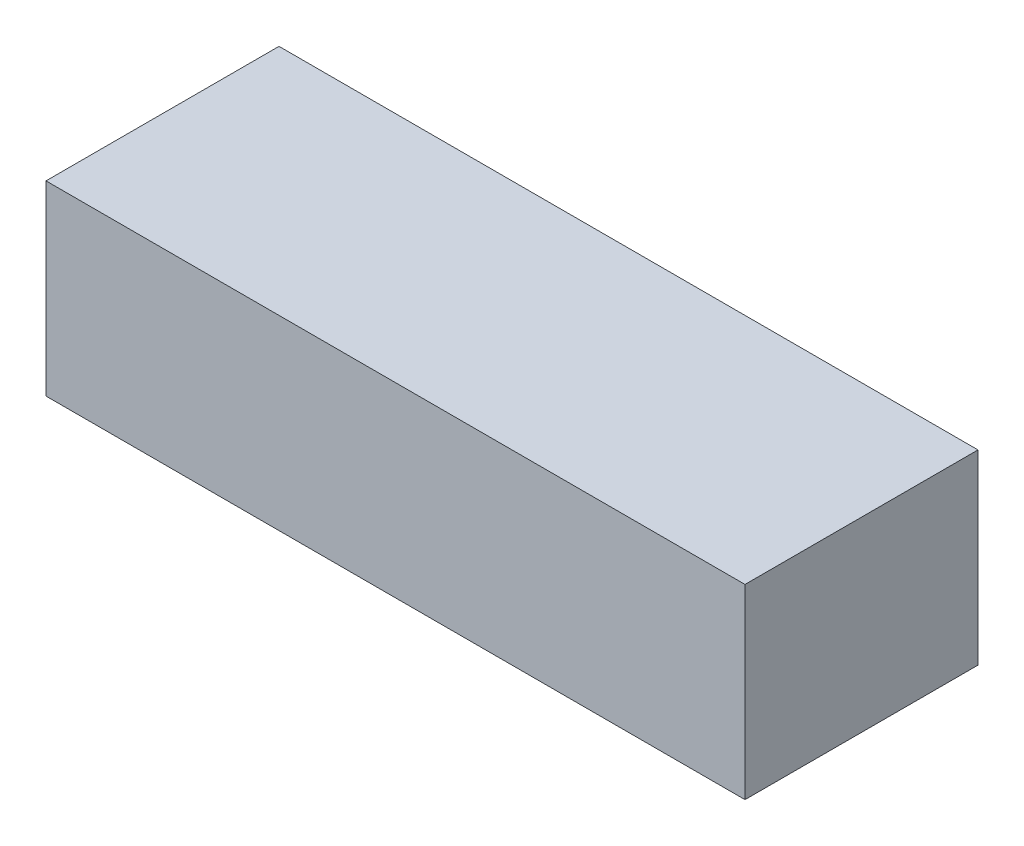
SolidWorks part; units mm, degrees
ref_plane "Front Plane" through (0, 0, 0) normal (0, 0, 1) x (1, 0, 0)
ref_plane "Top Plane" through (0, 0, 0) normal (0, 1, 0) x (1, 0, 0)
ref_plane "Right Plane" through (0, 0, 0) normal (1, 0, 0) x (0, 0, -1)
sketch "Sketch1" plane through (0, 0, 0) normal (0, 1, 0) x (1, 0, 0)
  line L1 (19.05, -6.35) -> (-19.05, -6.35)
  line L2 (19.05, -6.35) -> (19.05, 6.35)
  line L3 (19.05, 6.35) -> (-19.05, 6.35)
  line L4 (-19.05, -6.35) -> (-19.05, 6.35)
  line L5 (19.05, -6.35) -> (-19.05, 6.35) construction
  line L6 (19.05, 6.35) -> (-19.05, -6.35) construction
  point P0 (0, 0)
  dimension "D1" = 12.7
  dimension "D2" = 38.1
extrude "Boss-Extrude1" add sketch "Sketch1" along normal blind 10.16
